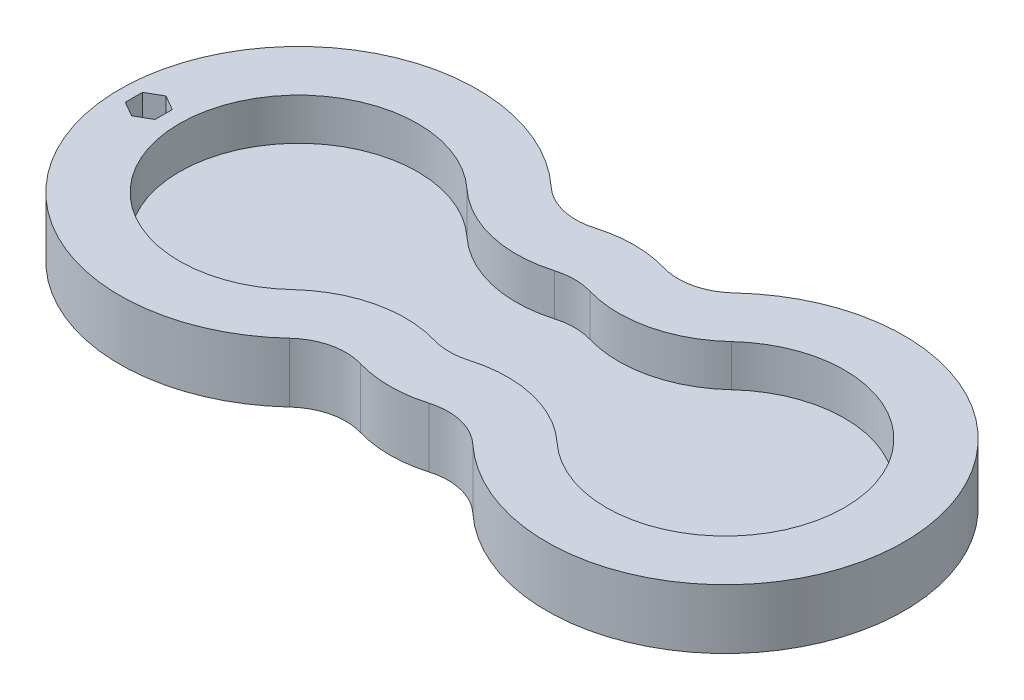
SolidWorks part; units mm, degrees
ref_plane "Front" through (0, 0, 0) normal (0, 0, 1) x (1, 0, 0)
ref_plane "Top" through (0, 0, 0) normal (0, 1, 0) x (1, 0, 0)
ref_plane "Right" through (0, 0, 0) normal (1, 0, 0) x (0, 0, -1)
sketch "Sketch1" plane through (0, 0, 0) normal (0, 1, 0) x (1, 0, 0)
  line L0 (0, 26.0556) -> (0, 61.7537) construction
  arc A0 (-7.3232, -25.0052) -> (7.3232, -25.0052) centre (0, 0) ccw
  arc A1 (19.5413, -27.8931) -> (19.5413, 27.8931) centre (45.4801, 0) ccw
  arc A2 (-19.5413, -27.8931) -> (-19.5413, 27.8931) centre (-45.4801, 0) cw
  arc A3 (7.3232, 25.0052) -> (-7.3232, 25.0052) centre (0, 0) ccw
  arc A4 (-7.3232, 25.0052) -> (-19.5413, 27.8931) centre (-10.8927, 37.1933) cw
  arc A5 (19.5413, 27.8931) -> (7.3232, 25.0052) centre (10.8927, 37.1933) cw
  arc A6 (19.5413, -27.8931) -> (7.3232, -25.0052) centre (10.8927, -37.1933) ccw
  arc A7 (-7.3232, -25.0052) -> (-19.5413, -27.8931) centre (-10.8927, -37.1933) ccw
  point P14 (14.2533, 21.8114)
  dimension "D1" = 12.7
extrude "Extrude1" add sketch "Sketch1" along normal blind 12.7
sketch "Sketch2" plane through (0, 12.7, 0) normal (0, 1, 0) x (1, 0, 0)
  arc A16 (-28.1898, 18.593) -> (-3.7537, 12.8172) centre (-10.8927, 37.1933) ccw
  arc A17 (-28.1898, 18.593) -> (-28.1898, -18.593) centre (-45.4801, 0) ccw
  arc A18 (-3.7537, -12.8172) -> (-28.1898, -18.593) centre (-10.8927, -37.1933) ccw
  arc A19 (-3.7537, -12.8172) -> (3.7537, -12.8172) centre (0, 0) ccw
  arc A20 (28.1898, -18.593) -> (3.7537, -12.8172) centre (10.8927, -37.1933) ccw
  arc A21 (28.1898, -18.593) -> (28.1898, 18.593) centre (45.4801, 0) ccw
  arc A22 (3.7537, 12.8172) -> (28.1898, 18.593) centre (10.8927, 37.1933) ccw
  arc A23 (3.7537, 12.8172) -> (-3.7537, 12.8172) centre (0, 0) ccw
  arc A24 (-28.1898, 18.593) -> (-3.7537, 12.8172) centre (-10.8927, 37.1933) ccw
  arc A25 (-28.1898, 18.593) -> (-28.1898, -18.593) centre (-45.4801, 0) ccw
  arc A26 (-3.7537, -12.8172) -> (-28.1898, -18.593) centre (-10.8927, -37.1933) ccw
  arc A27 (-3.7537, -12.8172) -> (3.7537, -12.8172) centre (0, 0) ccw
  arc A28 (28.1898, -18.593) -> (3.7537, -12.8172) centre (10.8927, -37.1933) ccw
  arc A29 (28.1898, -18.593) -> (28.1898, 18.593) centre (45.4801, 0) ccw
  arc A30 (3.7537, 12.8172) -> (28.1898, 18.593) centre (10.8927, 37.1933) ccw
  arc A31 (3.7537, 12.8172) -> (-3.7537, 12.8172) centre (0, 0) ccw
  dimension "D1" = 12.7
extrude "Cut-Extrude1" cut sketch "Sketch2" against normal blind 8.89
sketch "Sketch3" plane through (0, 12.7, 0) normal (0, 1, 0) x (1, 0, 0)
  line L0 (-77.3964, 0) -> (0, 0) construction
  line L1 (-77.3964, 3.6662) -> (-80.5714, 1.8331)
  line L2 (-80.5714, 1.8331) -> (-80.5714, -1.8331)
  line L3 (-80.5714, -1.8331) -> (-77.3964, -3.6662)
  line L4 (-77.3964, -3.6662) -> (-74.2214, -1.8331)
  line L5 (-74.2214, -1.8331) -> (-74.2214, 1.8331)
  line L6 (-74.2214, 1.8331) -> (-77.3964, 3.6662)
  circle A0 centre (-77.3964, 0) radius 3.175 construction
  dimension "D1" = 6.35
extrude "Cut-Extrude2" cut sketch "Sketch3" against normal blind 5.08
